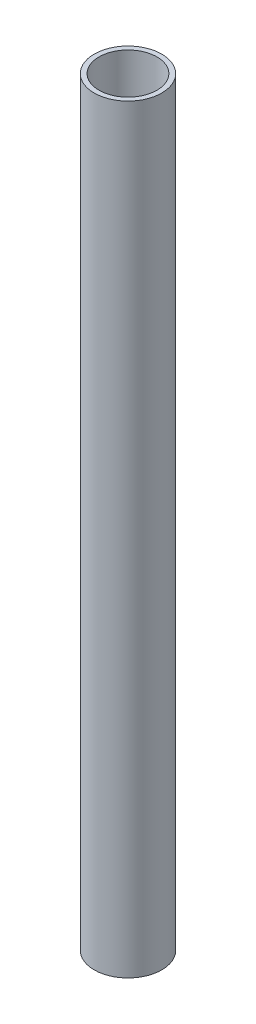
SolidWorks part; units mm, degrees
ref_plane "Alzado" through (0, 0, 0) normal (0, 0, 1) x (1, 0, 0)
ref_plane "Planta" through (0, 0, 0) normal (0, 1, 0) x (1, 0, 0)
ref_plane "Vista lateral" through (0, 0, 0) normal (1, 0, 0) x (0, 0, -1)
sketch "Croquis2" plane through (0, 0, 0) normal (0, 1, 0) x (1, 0, 0)
  circle A0 centre (0, 0) radius 22.225
  circle A1 centre (0, 0) radius 19.05
  dimension "D1" = 44.45
  dimension "D2" = 38.1
extrude "Saliente-Extruir1" add sketch "Croquis2" along normal blind 500
